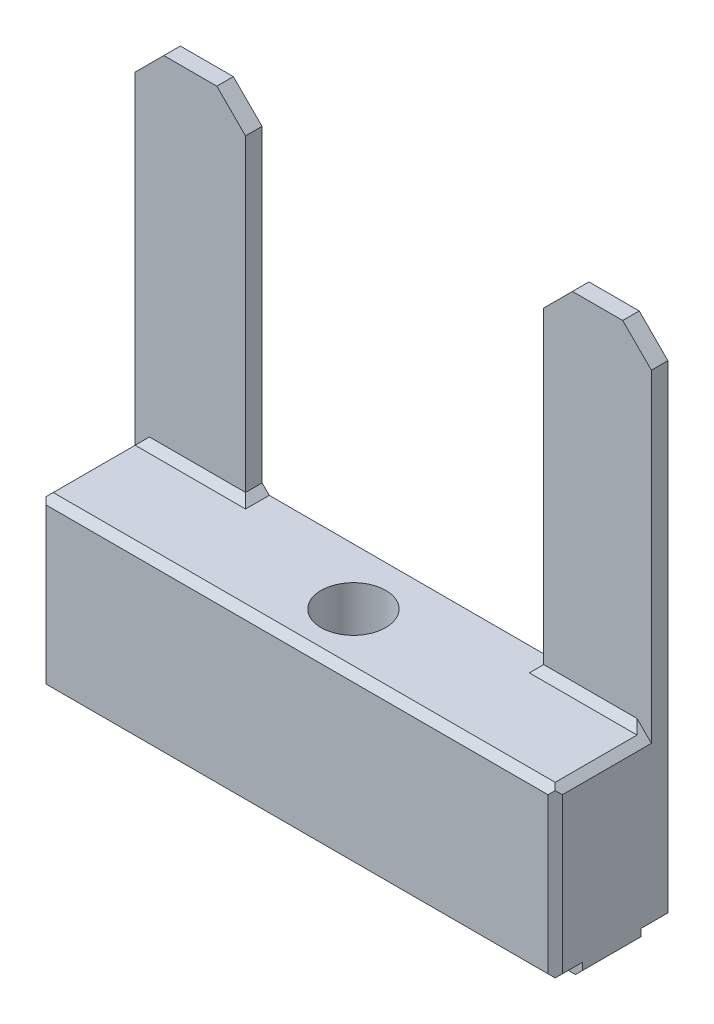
SolidWorks part; units mm, degrees
ref_plane "Front Plane" through (0, 0, 0) normal (0, 0, 1) x (1, 0, 0)
ref_plane "Top Plane" through (0, 0, 0) normal (0, 1, 0) x (1, 0, 0)
ref_plane "Right Plane" through (0, 0, 0) normal (1, 0, 0) x (0, 0, -1)
sketch "Sketch1" plane through (0, 0, 0) normal (0, 0, 1) x (1, 0, 0)
  line L1 (0, 0) -> (91.313, 0)
  line L2 (0, 0) -> (0, 90.932)
  line L3 (0, 90.932) -> (91.313, 90.932)
  line L4 (91.313, 0) -> (91.313, 90.932)
  dimension "D1" = 90.932
  dimension "D2" = 91.313
extrude "Boss-Extrude2" add sketch "Sketch1" along normal blind 2.921 contours L4 L3 L2 L1
sketch "Sketch2" plane through (0, 0, 2.921) normal (0, 0, 1) x (1, 0, 0)
  line L0 (0, 0) -> (0, 90.932) construction
  line L1 (0, 0) -> (91.313, 0)
  line L2 (0, 0) -> (0, 29.972)
  line L3 (0, 29.972) -> (91.313, 29.972)
  line L4 (91.313, 0) -> (91.313, 29.972)
  line L5 (0, 0) -> (91.313, 0) construction
  dimension "D1" = 29.972
  dimension "D2" = 0
  dimension "D3" = 0
  dimension "D4" = 91.313
extrude "Boss-Extrude3" add sketch "Sketch2" along normal blind 17.018 contours L3 L4 L1 L2
sketch "Sketch3" plane through (0, 0, 0) normal (0, -1, 0) x (1, 0, 0)
  line L0 (0, 19.939) -> (0, 0) construction
  line L1 (0, 15.0876) -> (91.313, 15.0876)
  line L2 (0, 15.0876) -> (0, 4.7752)
  line L3 (0, 4.7752) -> (91.313, 4.7752)
  line L4 (91.313, 15.0876) -> (91.313, 4.7752)
  line L5 (0, 0) -> (91.313, 0) construction
  dimension "D1" = 0
  dimension "D2" = 91.313
  dimension "D3" = 10.3124
  dimension "D4" = 4.7752
extrude "Boss-Extrude4" add sketch "Sketch3" along normal blind 1.27 contours L3 L4 L1 L2
sketch "Sketch4" plane through (0, 0, 2.921) normal (0, 0, 1) x (1, 0, 0)
  line L0 (91.313, 29.972) -> (91.313, 90.932) construction
  line L1 (72.263, 29.972) -> (19.5326, 29.972)
  line L2 (72.263, 29.972) -> (72.263, 90.932)
  line L3 (72.263, 90.932) -> (19.5326, 90.932)
  line L4 (19.5326, 29.972) -> (19.5326, 90.932)
  dimension "D1" = 52.7304
  dimension "D2" = 19.05
  dimension "D3" = 60.96
extrude "Cut-Extrude1" cut sketch "Sketch4" against normal through all contours L2 L3 L4 L1
chamfer "Chamfer1" distance 1.27 angle 45 1 edges at (45.6565, 29.972, 19.939)
chamfer "Chamfer2" distance 1.27 angle 45 3 edges at (0, 14.351, 19.939) (45.6565, 0, 19.939) (91.313, 14.351, 19.939)
chamfer "Chamfer3" distance 1.27 angle 45 2 edges at (0, 29.972, 10.795) (91.313, 29.972, 10.795)
chamfer "Chamfer4" distance 1.27 angle 45 1 edges at (45.6565, 0, 0)
chamfer "Chamfer5" distance 1.27 angle 45 3 edges at (91.313, 0, 3.0226) (91.313, -1.27, 9.9314) (91.313, 0, 16.8783)
chamfer "Chamfer6" distance 1.27 angle 45 3 edges at (0, 0, 3.0226) (0, -1.27, 9.9314) (0, 0, 16.8783)
chamfer "Chamfer7" distance 1.27 angle 45 2 edges at (10.4013, 29.972, 2.921) (81.153, 29.972, 2.921)
chamfer "Chamfer8" distance 1.27 angle 45 2 edges at (19.5326, 29.972, 2.0955) (72.263, 29.972, 2.0955)
chamfer "Chamfer9" distance 5.08 angle 45 1 edges at (91.313, 90.932, 1.4605)
chamfer "Chamfer10" distance 5.08 angle 45 3 edges at (0, 90.932, 1.4605) (19.5326, 90.932, 1.4605) (72.263, 90.932, 1.4605)
sketch "Sketch5" plane through (0, 29.972, 0) normal (0, 1, 0) x (1, 0, 0)
  circle A0 centre (45.6565, -9.9695) radius 5.715
extrude "Cut-Extrude2" cut sketch "Sketch5" against normal blind 11.176 contours A0
sketch "Sketch6" plane through (0, 18.796, 0) normal (0, 1, 0) x (1, 0, 0)
  circle A0 centre (45.6565, -9.9695) radius 3.302
extrude "Cut-Extrude3" cut sketch "Sketch6" against normal through all contours A0
